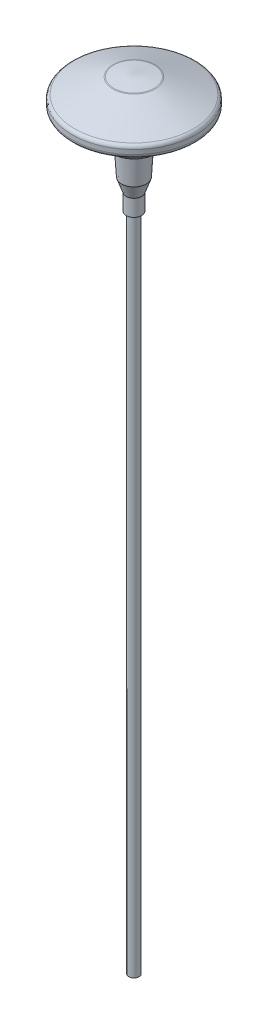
SolidWorks part; units mm, degrees
ref_plane "Front" through (0, 0, 0) normal (0, 0, 1) x (1, 0, 0)
ref_plane "Top" through (0, 0, 0) normal (0, 1, 0) x (1, 0, 0)
ref_plane "Right" through (0, 0, 0) normal (1, 0, 0) x (0, 0, -1)
sketch "Sketch1" plane through (0, 5.7997, 0) normal (0, 0, 1) x (1, 0, 0)
  line L0 (0, -79.2875) -> (4.7752, -79.2875)
  line L1 (4.7752, -79.2875) -> (4.7752, -69.1275)
  line L2 (4.7752, -69.1275) -> (7.62, -61.0447)
  line L3 (7.62, -61.0447) -> (8.7376, -41.9947)
  line L4 (8.7376, -41.9947) -> (13.5128, -41.9947)
  line L5 (13.5128, -41.9947) -> (18.9581, -30.3596)
  line L6 (20.5909, -28.9856) -> (36.2278, -24.7249)
  line L7 (38.1, -22.2742) -> (38.1, -19.5844)
  line L8 (36.5033, -17.2261) -> (12.9743, -7.8145)
  line L9 (0, -5.7997) -> (0, -79.2875)
  line L10 (0, 18.1083) -> (0, -116.6515) construction
  line L11 (12.4078, -7.6609) -> (0, -5.7997)
  arc A0 (12.9743, -7.8145) -> (12.4078, -7.6609) centre (12.031, -10.1728) ccw
  arc A1 (38.1, -19.5844) -> (36.5033, -17.2261) centre (35.56, -19.5844) ccw
  arc A2 (38.1, -22.2742) -> (36.2278, -24.7249) centre (35.56, -22.2742) cw
  arc A3 (18.9581, -30.3596) -> (20.5909, -28.9856) centre (21.2587, -31.4363) cw
  point P19 (12.7, -7.7047)
  point P22 (38.1, -17.8647)
  point P25 (38.1, -24.2147)
  point P28 (19.4565, -29.2947)
  dimension "D20" = 2.54
  dimension "D1" = 4.7752
  dimension "D2" = 8.7376
  dimension "D3" = 19.05
  dimension "D4" = 25.08
  dimension "D5" = 19.39
  dimension "D6" = 7.62
  dimension "D7" = 38.1
  dimension "D8" = 6.35
  dimension "D9" = 10.16
  dimension "D10" = 5.08
  dimension "D11" = 12.7
  dimension "D12" = 12.7
  dimension "D13" = 13.5128
  dimension "D14" = 10.16
  dimension "D15" = 98.531
  dimension "D16" = 1.905
  dimension "D17" = 3.358
  dimension "D18" = 73.4877
  dimension "D19" = 111.801
revolve "Base-Revolve" add sketch "Sketch1" angle 360 about L10
sketch "Sketch2" plane through (0, -73.4877, 0) normal (0, -1, 0) x (1, 0, 0)
  circle A0 centre (0, 0) radius 3.175
  dimension "D1" = 6.35
sketch "Sketch3" plane through (0, 0, 0) normal (0, 0, 1) x (1, 0, 0)
  line L0 (0, -73.4877) -> (0, -479.8877)
  line L1 (0, 23.9081) -> (0, -110.8518) construction
  dimension "D1" = 406.4
sweep "Boss-Sweep1" add profiles "Sketch2" path "Sketch3"
